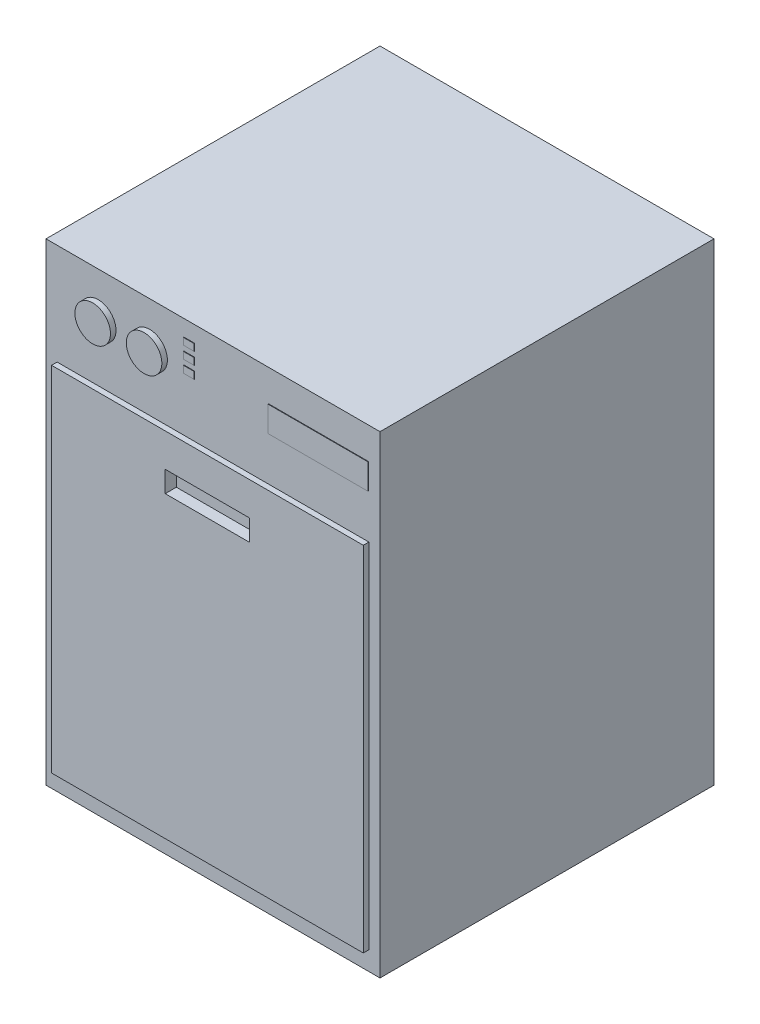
SolidWorks part; units mm, degrees
ref_plane "Plan de face" through (0, 0, 0) normal (0, 0, 1) x (1, 0, 0)
ref_plane "Plan de dessus" through (0, 0, 0) normal (0, 1, 0) x (1, 0, 0)
ref_plane "Plan de droite" through (0, 0, 0) normal (1, 0, 0) x (0, 0, -1)
sketch "Esquisse1" plane through (0, 0, 0) normal (0, 1, 0) x (1, 0, 0)
  line L1 (300, -300) -> (-300, -300)
  line L2 (300, -300) -> (300, 300)
  line L3 (300, 300) -> (-300, 300)
  line L4 (-300, -300) -> (-300, 300)
  line L5 (300, -300) -> (-300, 300) construction
  line L6 (300, 300) -> (-300, -300) construction
  point P0 (0, 0)
  dimension "D1" = 600
  dimension "D2" = 600
extrude "Boss.-Extru.1" add sketch "Esquisse1" along normal blind 850
sketch "Esquisse3" plane through (0, 0, 300) normal (0, 0, 1) x (1, 0, 0)
  circle A0 centre (-206.2058, 770.3565) radius 31.9295
  circle A1 centre (-113.8431, 770.3565) radius 31.9295
extrude "Boss.-Extru.2" add sketch "Esquisse3" along normal blind 10
sketch "Esquisse5" plane through (0, 0, 300) normal (0, 0, 1) x (1, 0, 0)
  line L0 (-300, 850) -> (-300, 0) construction
  line L1 (-280, 33.9127) -> (280, 33.9127)
  line L2 (-280, 33.9127) -> (-280, 668.2559)
  line L3 (-280, 668.2559) -> (280, 668.2559)
  line L4 (280, 33.9127) -> (280, 668.2559)
  line L5 (300, 850) -> (300, 0) construction
  dimension "D1" = 20
  dimension "D2" = 20
extrude "Boss.-Extru.4" add sketch "Esquisse5" along normal blind 10
sketch "Esquisse6" plane through (0, 0, 310) normal (0, 0, 1) x (1, 0, 0)
  line L1 (75.8261, 570.6207) -> (-75.8261, 570.6207)
  line L2 (75.8261, 570.6207) -> (75.8261, 608.5337)
  line L3 (75.8261, 608.5337) -> (-75.8261, 608.5337)
  line L4 (-75.8261, 570.6207) -> (-75.8261, 608.5337)
  line L5 (75.8261, 570.6207) -> (-75.8261, 608.5337) construction
  line L6 (75.8261, 608.5337) -> (-75.8261, 570.6207) construction
  point P0 (0, 589.5772)
extrude "Enlèv. mat.-Extru.1" cut sketch "Esquisse6" against normal blind 20
sketch "Esquisse7" plane through (0, 0, 300) normal (0, 0, 1) x (1, 0, 0)
  line L1 (279.2732, 793.2249) -> (100.0437, 793.2249)
  line L2 (279.2732, 793.2249) -> (279.2732, 747.4539)
  line L3 (279.2732, 747.4539) -> (100.0437, 747.4539)
  line L4 (100.0437, 793.2249) -> (100.0437, 747.4539)
  line L5 (279.2732, 793.2249) -> (100.0437, 747.4539) construction
  line L6 (279.2732, 747.4539) -> (100.0437, 793.2249) construction
  point P0 (189.6584, 770.3394)
extrude "Boss.-Extru.5" add sketch "Esquisse7" along normal blind 1
sketch "Esquisse8" plane through (0, 0, 300) normal (0, 0, 1) x (1, 0, 0)
  line L1 (-52.39, 821.0091) -> (-32.9059, 821.0091)
  line L2 (-52.39, 821.0091) -> (-52.39, 808.9475)
  line L3 (-52.39, 808.9475) -> (-32.9059, 808.9475)
  line L4 (-32.9059, 821.0091) -> (-32.9059, 808.9475)
  line L5 (-52.39, 821.0091) -> (-32.9059, 808.9475) construction
  line L6 (-52.39, 808.9475) -> (-32.9059, 821.0091) construction
  line L7 (-52.39, 799.2768) -> (-32.9059, 799.2768)
  line L8 (-52.39, 799.2768) -> (-52.39, 787.1438)
  line L9 (-52.39, 787.1438) -> (-32.9059, 787.1438)
  line L10 (-32.9059, 799.2768) -> (-32.9059, 787.1438)
  line L11 (-52.39, 799.2768) -> (-32.9059, 787.1438) construction
  line L12 (-52.39, 787.1438) -> (-32.9059, 799.2768) construction
  line L13 (-52.39, 777.6583) -> (-32.9059, 777.6583)
  line L14 (-52.39, 777.6583) -> (-52.39, 765.3402)
  line L15 (-52.39, 765.3402) -> (-32.9059, 765.3402)
  line L16 (-32.9059, 777.6583) -> (-32.9059, 765.3402)
  line L17 (-52.39, 777.6583) -> (-32.9059, 765.3402) construction
  line L18 (-52.39, 765.3402) -> (-32.9059, 777.6583) construction
  point P0 (-42.648, 814.9783)
  point P5 (-42.648, 793.2103)
  point P10 (-42.648, 771.4992)
extrude "Boss.-Extru.6" add sketch "Esquisse8" along normal blind 1
